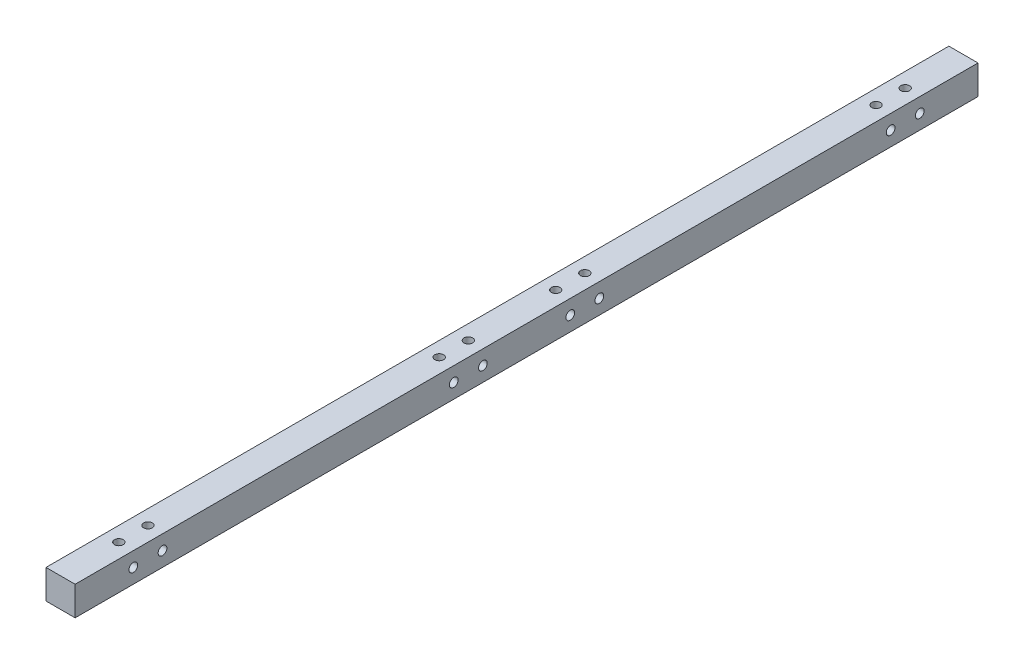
SolidWorks part; units mm, degrees
ref_plane "Plan de face" through (0, 0, 0) normal (0, 0, 1) x (1, 0, 0)
ref_plane "Plan de dessus" through (0, 0, 0) normal (0, 1, 0) x (1, 0, 0)
ref_plane "Plan de droite" through (0, 0, 0) normal (1, 0, 0) x (0, 0, -1)
sketch "Esquisse1" plane through (0, 0, 0) normal (0, 0, 1) x (1, 0, 0)
  line L1 (0, 0) -> (10, 0)
  line L2 (0, 0) -> (0, 10)
  line L3 (0, 10) -> (10, 10)
  line L4 (10, 0) -> (10, 10)
  dimension "D1" = 10
  dimension "D2" = 10
extrude "Extrusion1" add sketch "Esquisse1" along normal blind 310
sketch "Esquisse2" plane through (10, 0, 0) normal (1, 0, 0) x (0, 0, -1)
  line L1 (-310, 10) -> (0, 10) construction
  line L2 (-155, 68) -> (-155, -77) construction
  line L3 (-230, 71) -> (-230, -83) construction
  line L4 (-310, 10) -> (0, 10) construction
  circle A0 centre (-170, 5) radius 1.5
  circle A2 centre (-180, 5) radius 1.5
  circle A3 centre (-280, 5) radius 1.5
  circle A4 centre (-290, 5) radius 1.5
  circle A5 centre (-20, 5) radius 1.5
  circle A6 centre (-30, 5) radius 1.5
  circle A7 centre (-130, 5) radius 1.5
  circle A8 centre (-140, 5) radius 1.5
  dimension "D1" = 3
  dimension "D2" = 5
  dimension "D3" = 155
  dimension "D4" = 75
  dimension "D5" = 60
  dimension "D6" = 50
  dimension "D7" = 5
extrude "Enlèv. mat.-Extru.1" cut sketch "Esquisse2" against normal through all
sketch "Esquisse3" plane through (0, 10, 0) normal (0, 1, 0) x (-1, 0, 0)
  line L0 (54, 155) -> (-61, 155) construction
  line L1 (59, 80) -> (-66, 80) construction
  line L2 (5.5, 0) -> (-5.5, 0) construction
  circle A0 centre (-5, 140) radius 1.5
  circle A1 centre (-5, 130) radius 1.5
  circle A2 centre (-5, 20) radius 1.5
  circle A3 centre (-5, 30) radius 1.5
  circle A4 centre (-5, 170) radius 1.5
  circle A5 centre (-5, 180) radius 1.5
  circle A6 centre (-5, 280) radius 1.5
  circle A7 centre (-5, 290) radius 1.5
  dimension "D1" = 155
  dimension "D3" = 3
  dimension "D4" = 3
  dimension "D2" = 75
  dimension "D5" = 60
  dimension "D6" = 50
extrude "Enlèv. mat.-Extru.2" cut sketch "Esquisse3" against normal through all
